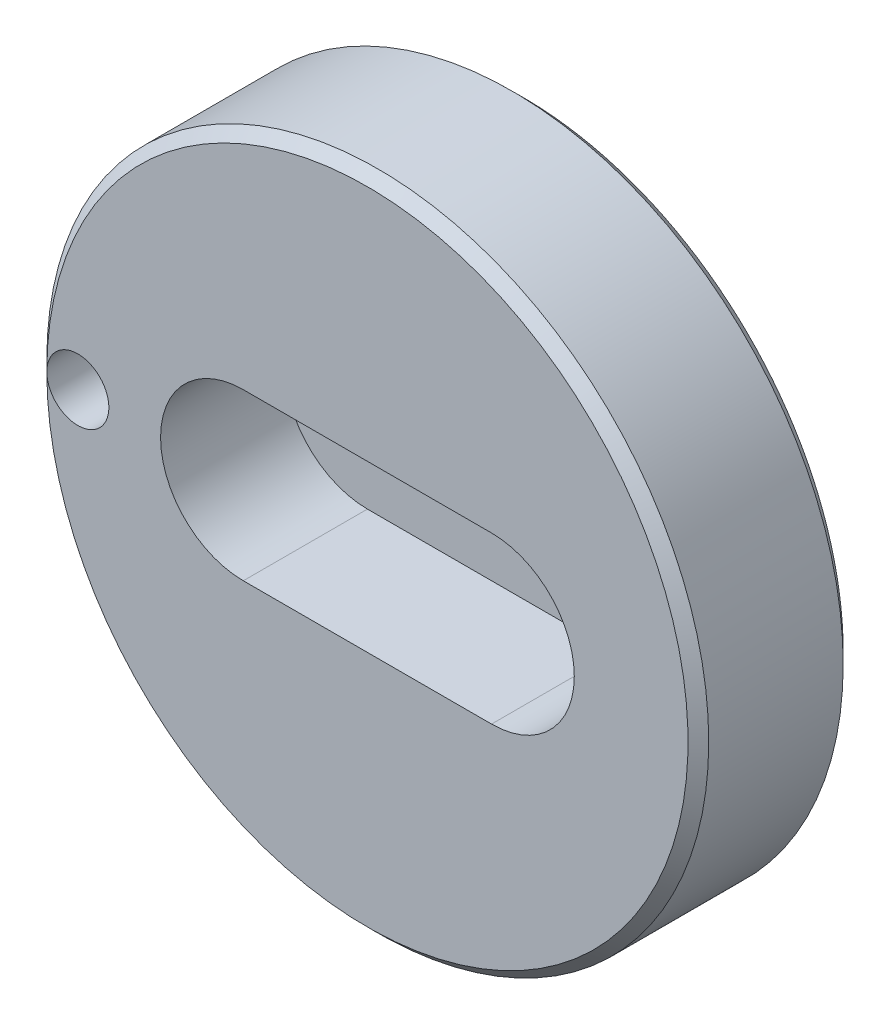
SolidWorks part; units mm, degrees
ref_plane "Face" through (0, 0, 0) normal (0, 0, 1) x (1, 0, 0)
ref_plane "Dessus" through (0, 0, 0) normal (0, 1, 0) x (1, 0, 0)
ref_plane "Droite" through (0, 0, 0) normal (1, 0, 0) x (0, 0, -1)
sketch "Esquisse1" plane through (0, 0, 0) normal (0, 0, 1) x (1, 0, 0)
  line L0 (0, 0) -> (-16, 0) construction
  circle A0 centre (0, 0) radius 16
  circle A1 centre (-14, 0) radius 1.5
  point P0 (-14, 0)
  dimension "D5" = 32
  dimension "D2" = 3
  dimension "D1" = 14
extrude "Boss.-Extru.1" add sketch "Esquisse1" along normal blind 7.5
sketch "Esquisse2" plane through (0, 0, 0) normal (0, 0, -1) x (-1, 0, 0)
  circle A0 centre (0, 0) radius 5.6
  dimension "D1" = 11.2
extrude "Boss.-Extru.2" add sketch "Esquisse2" along normal blind 3
chamfer "Chanfrein1" distance 0.5 angle 45 3 edges at (-5.6, 0, -3) (16, 0, 0) (16, 0, 7.5)
sketch "Esquisse3" plane through (0, 0, 7.5) normal (0, 0, 1) x (1, 0, 0)
  line L0 (-16, 0) -> (16, 0) construction
  line L1 (-6, 0) -> (6, 0) construction
  line L8 (-6, 4) -> (6, 4)
  line L9 (-6, -4) -> (6, -4)
  circle A0 centre (0, 0) radius 16 construction
  arc A7 (-6, 4) -> (-6, -4) centre (-6, 0) ccw
  arc A8 (6, -4) -> (6, 4) centre (6, 0) ccw
  point P7 (0, 0)
  dimension "D1" = 4
  dimension "D2" = 12
extrude "Enlèv. mat.-Extru.1" cut sketch "Esquisse3" against normal blind 6
